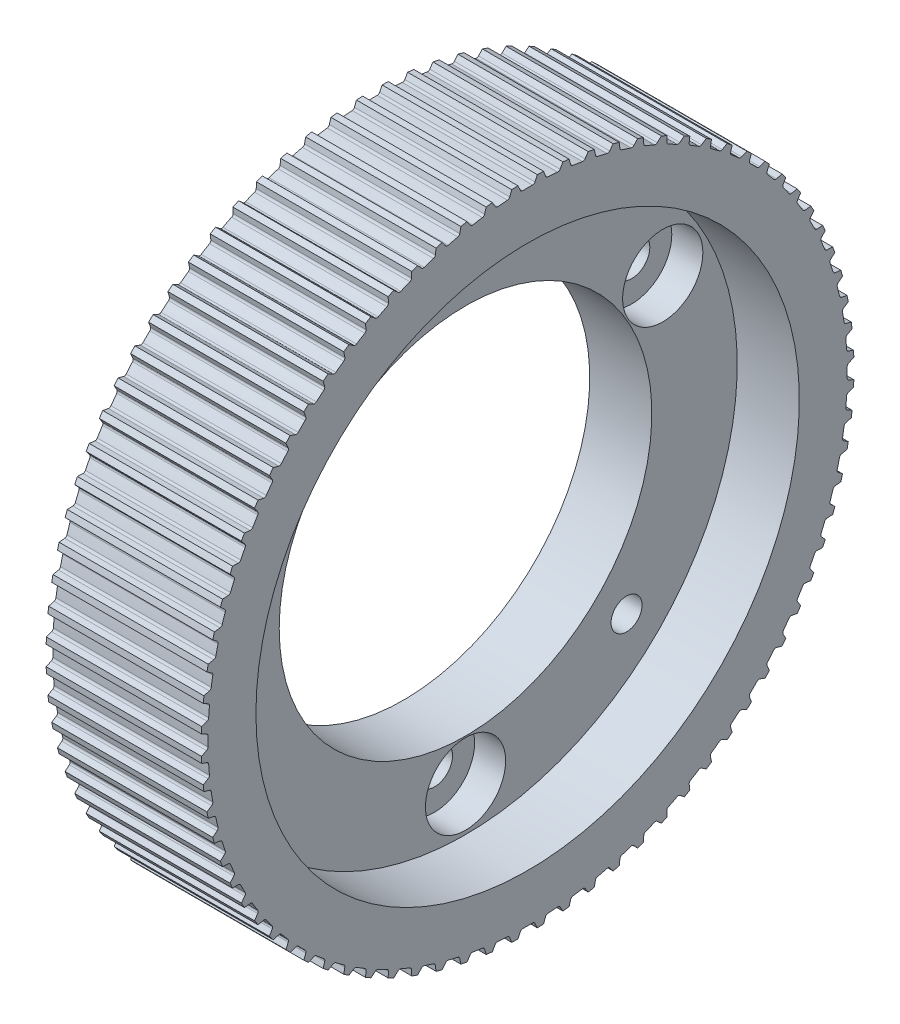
SolidWorks part; units mm, degrees
ref_plane "Plan de face" through (0, 0, 0) normal (0, 0, 1) x (1, 0, 0)
ref_plane "Plan de dessus" through (0, 0, 0) normal (0, 1, 0) x (1, 0, 0)
ref_plane "Plan de droite" through (0, 0, 0) normal (1, 0, 0) x (0, 0, -1)
sketch "Esquisse1" plane through (0, 0, 0) normal (0, 0, 1) x (1, 0, 0)
  line L0 (-35.3225, 0) -> (46.8564, 0) construction
  line L1 (0, 36) -> (0, 49)
  line L2 (0, 49) -> (-6, 49)
  line L3 (-6, 49) -> (-6, 63.05)
  line L4 (-6, 63.05) -> (24, 63.05)
  line L5 (24, 63.05) -> (24, 52.5)
  line L6 (24, 52.5) -> (12, 52.5)
  line L7 (12, 52.5) -> (12, 36)
  line L8 (12, 36) -> (0, 36)
  dimension "D1" = 72
  dimension "D2" = 126.1
  dimension "D3" = 98
  dimension "D4" = 105
  dimension "D5" = 30
  dimension "D6" = 6
  dimension "D7" = 12
revolve "Révolution1" add sketch "Esquisse1" angle 360 about L0
sketch "Esquisse2" plane through (12, 0, 0) normal (1, 0, 0) x (0, 0, -1)
  line L0 (-68.9482, 0) -> (69.4157, 0) construction
  line L1 (0, 0) -> (31.1127, -31.1127) construction
  line L3 (0, 3.6227) -> (0, 57.8464) construction
  circle A0 centre (0, 44) radius 3
  circle A1 centre (31.1127, -31.1127) radius 3
  circle A2 centre (0, -44) radius 3.5
  circle A3 centre (-38.1051, 22) radius 3.5
  circle A4 centre (38.1051, 22) radius 3.5
  dimension "D4" = 6
  dimension "D6" = 7
  dimension "D1" = 45
  dimension "D2" = 44
  dimension "D3" = 44
  dimension "D5" = 44
extrude "Enlèv. mat.-Extru.1" cut sketch "Esquisse2" against normal up to next
sketch "Esquisse3" plane through (12, 0, 0) normal (1, 0, 0) x (0, 0, -1)
  circle A0 centre (0, -44) radius 7.75
  dimension "D1" = 15.5
extrude "Enlèv. mat.-Extru.3" cut sketch "Esquisse3" against normal blind 6
pattern_circular "Répétition circulaire1" count 3 every 120 about axis through (0, 0, 0) along (1, 0, 0) of "Enlèv. mat.-Extru.3"
sketch "Esquisse4" plane through (24, 0, 0) normal (1, 0, 0) x (0, 0, -1)
  line L0 (0, 44) -> (0, 75.6014) construction
  line L1 (-2.155, 63.6335) -> (-1.4079, 62.0314)
  line L2 (2.155, 63.6335) -> (1.4079, 62.0314)
  arc A0 (-0.9471, 61.7427) -> (0.9471, 61.7427) centre (0, 0) cw
  arc A1 (-2.155, 63.6335) -> (2.155, 63.6335) centre (0, 0) cw
  arc A2 (-0.9471, 61.7427) -> (-1.4079, 62.0314) centre (-0.9548, 62.2427) cw
  arc A3 (1.4079, 62.0314) -> (0.9471, 61.7427) centre (0.9548, 62.2427) cw
  point P11 (-1.2706, 61.7369)
  point P14 (1.2706, 61.7369)
  dimension "D1" = 63.67
  dimension "D2" = 61.75
  dimension "D6" = 0.5
  dimension "D3" = 4.31
  dimension "D5" = 50
extrude "Enlèv. mat.-Extru.4" cut sketch "Esquisse4" against normal up to next
pattern_circular "Répétition circulaire2" count 80 every 4.5 about axis through (0, 0, 0) along (1, 0, 0) of "Enlèv. mat.-Extru.4"
